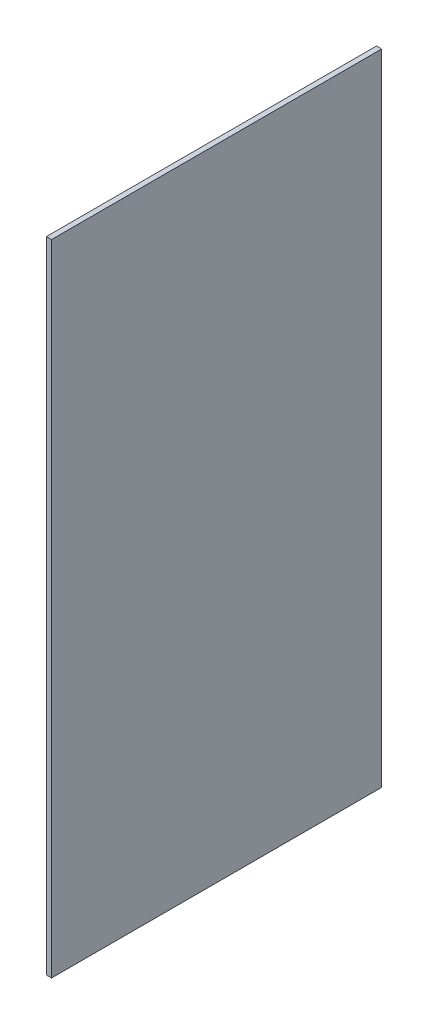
SolidWorks part; units mm, degrees
ref_plane "Front Plane" through (0, 0, 0) normal (1, 0, 0) x (0, 1, 0)
ref_plane "Top Plane" through (0, 0, 0) normal (0, 0, 1) x (0, 1, 0)
ref_plane "Right Plane" through (0, 0, 0) normal (0, 1, 0) x (-1, 0, 0)
sketch "Sketch1" plane through (0, 0, 0) normal (0, 1, 0) x (-1, 0, 0)
  line L1 (-4.7625, 304.8) -> (4.7625, 304.8)
  line L2 (-4.7625, 304.8) -> (-4.7625, -304.8)
  line L3 (-4.7625, -304.8) -> (4.7625, -304.8)
  line L4 (4.7625, 304.8) -> (4.7625, -304.8)
  line L5 (-4.7625, 304.8) -> (4.7625, -304.8) construction
  line L6 (-4.7625, -304.8) -> (4.7625, 304.8) construction
  point P0 (0, 0)
  dimension "D1" = 609.6
  dimension "D2" = 9.525
extrude "Boss-Extrude1" add sketch "Sketch1" along normal blind 1181.1
